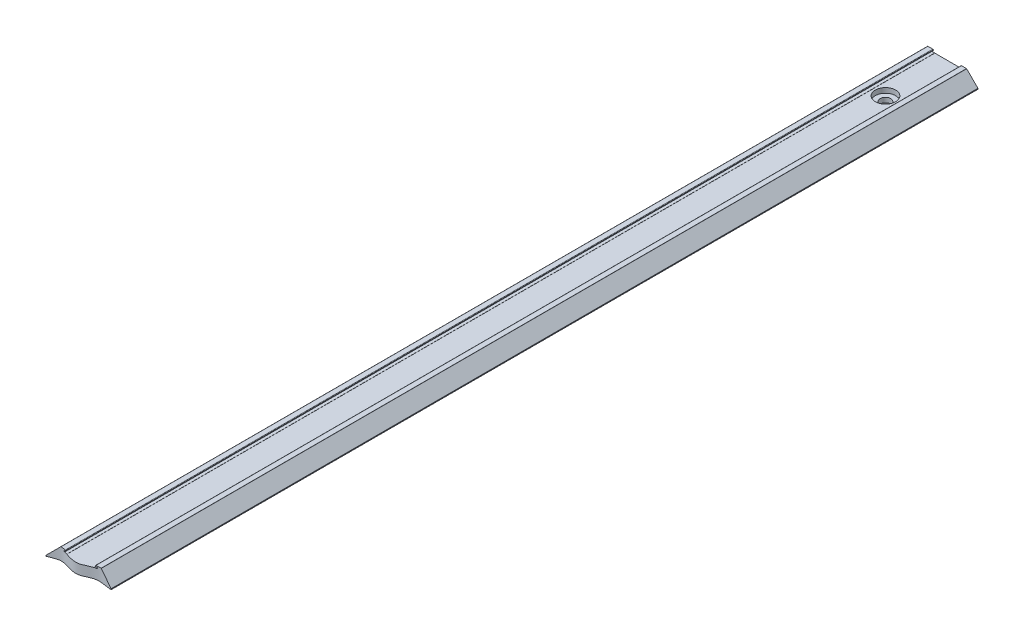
SolidWorks part; units mm, degrees
ref_plane "Front Plane" through (0, 0, 0) normal (0, 0, 1) x (1, 0, 0)
ref_plane "Top Plane" through (0, 0, 0) normal (0, 1, 0) x (1, 0, 0)
ref_plane "Right Plane" through (0, 0, 0) normal (1, 0, 0) x (0, 0, -1)
sketch "Sketch1" plane through (0, 0, 0) normal (0, 0, 1) x (1, 0, 0)
  line L0 (0.1, 0) -> (3, 0)
  line L1 (0, 0.1) -> (0, 0.2586)
  line L2 (0.0293, 0.3293) -> (3.6707, 3.9707)
  line L3 (3.7414, 4) -> (5.35, 4)
  line L4 (5.5, 3.85) -> (5.5, 3.75)
  line L5 (5.35, 3.6) -> (5.025, 3.6)
  line L6 (4.875, 3.45) -> (4.875, 3.4)
  line L7 (5.025, 3.25) -> (6, 3.25)
  line L8 (15.125, 3.4) -> (15.125, 3.45)
  line L9 (14.975, 3.6) -> (14.65, 3.6)
  line L10 (14.5, 3.75) -> (14.5, 3.85)
  line L11 (14.65, 4) -> (16.2586, 4)
  line L12 (16.3293, 3.9707) -> (19.9707, 0.3293)
  line L13 (20, 0.2586) -> (20, 0.1)
  line L14 (19.9, 0) -> (17, 0)
  line L15 (17, 0) -> (17, 0.05)
  line L16 (17, 0.05) -> (3, 0.05)
  line L17 (3, 0.05) -> (3, 0)
  line L18 (14, 3.25) -> (14.975, 3.25)
  line L19 (0, 0) -> (0.801, 0) construction
  line L20 (6, 3.25) -> (6, 3.2)
  line L21 (6, 3.2) -> (9.9, 3.2)
  line L22 (14, 3.25) -> (14, 3.2)
  line L23 (0, 0) -> (0, 0.3) construction
  line L24 (9.9, 3.2) -> (14, 3.2)
  line L25 (0, 0.3) -> (0.2634, 0.5634) construction
  arc A0 (5.025, 3.6) -> (4.875, 3.45) centre (5.025, 3.45) ccw
  arc A1 (5.025, 3.25) -> (4.875, 3.4) centre (5.025, 3.4) cw
  arc A2 (5.5, 3.75) -> (5.35, 3.6) centre (5.35, 3.75) cw
  arc A3 (5.35, 4) -> (5.5, 3.85) centre (5.35, 3.85) cw
  arc A4 (15.125, 3.4) -> (14.975, 3.25) centre (14.975, 3.4) cw
  arc A5 (14.975, 3.6) -> (15.125, 3.45) centre (14.975, 3.45) cw
  arc A6 (14.5, 3.75) -> (14.65, 3.6) centre (14.65, 3.75) ccw
  arc A7 (14.65, 4) -> (14.5, 3.85) centre (14.65, 3.85) ccw
  arc A8 (20, 0.1) -> (19.9, 0) centre (19.9, 0.1) cw
  arc A9 (19.9707, 0.3293) -> (20, 0.2586) centre (19.9, 0.2586) cw
  arc A10 (16.3293, 3.9707) -> (16.2586, 4) centre (16.2586, 3.9) ccw
  arc A11 (3.6707, 3.9707) -> (3.7414, 4) centre (3.7414, 3.9) cw
  arc A12 (0.0293, 0.3293) -> (0, 0.2586) centre (0.1, 0.2586) ccw
  arc A13 (0.1, 0) -> (0, 0.1) centre (0.1, 0.1) cw
  point P42 (20, 0)
  point P45 (20, 0.3)
  point P52 (0, 0.3)
  point P55 (0, 0)
  dimension "D17" = 0.15
  dimension "D19" = 3.2
  dimension "D24" = 0.1
  dimension "D1" = 20
  dimension "D2" = 3
  dimension "D3" = 3
  dimension "D4" = 0.3
  dimension "D5" = 0.3
  dimension "D6" = 0.05
  dimension "D7" = 4
  dimension "D8" = 4
  dimension "D9" = 10.25
  dimension "D10" = 4.875
  dimension "D11" = 0.75
  dimension "D12" = 0.35
  dimension "D13" = 0.35
  dimension "D14" = 9
  dimension "D15" = 0.625
  dimension "D16" = 135
  dimension "D18" = 4.875
  dimension "D20" = 0.625
  dimension "D21" = 8
  dimension "D22" = 6
  dimension "D23" = 0.05
extrude "Extrude1" add sketch "Sketch1" along normal blind 300
sketch "Sketch2" plane through (0, 4, 0) normal (0, 1, 0) x (1, 0, 0)
  line L0 (3.7414, -300) -> (3.7414, 0) construction
  line L1 (14, -300) -> (14, 0) construction
  spline S0 degree 3 poles (-3.6357, -323.3191) (-12.2084, -298.6979) (-8.4038, -283.646) (-1.4319, -283.3052) (4.0195, -279.86) (9.5697, -283.3863) (14.6449, -279.8714) (21.0579, -281.7841) (37.5476, -278.9693) (38.2285, -320.4131) (-3.6357, -323.3191) (-12.2084, -298.6979) (-8.4038, -283.646) knots -0.665987 -0.442283 -0.20571 0 0.053323 0.099695 0.140115 0.190475 0.219711 0.26621 0.334013 0.557717 0.79429 1 1.053323 1.099695 1.140115 only from (-9.9834, -291.1918) to (-9.9834, -291.1918)
extrude "Extrude2" cut sketch "Sketch2" against normal blind 5
hole_wizard "CBORE for M3 Hex Socket Head Cap Screw1" positions "Sketch5" profile "Sketch4" counterbore size "M3" standard "DIN"
sketch "Sketch5" plane through (0, 3.2, 0) normal (0, 1, 0) x (-1, 0, 0)
  line L0 (-14, 0) -> (-6, 0) construction
  line L1 (0, 282.2011) -> (0, 0) construction
  point P0 (-10, 20)
  dimension "D1" = 20
  dimension "D2" = 10
sketch "Sketch4" plane through (10, 3.2, 20) normal (1, 0, 0) x (0, 0, 1)
  line L0 (0, 0) -> (0, 3.2)
  line L1 (0, 3.2) -> (1.7, 3.2)
  line L3 (1.7, 3.2) -> (1.7, 1.6)
  line L4 (1.7, 1.6) -> (3.3, 1.6)
  line L5 (3.3, 1.6) -> (3.3, 0)
  line L7 (3.3, 0) -> (0, 0)
  line L11 (0, -6.35) -> (0, 107.95) construction
  dimension "Thru Hole Dia." = 3.4
  dimension "Thru Hole Depth" = 3.2
  dimension "C'Bore Dia." = 6.6
  dimension "C'Bore Depth" = 1.6
